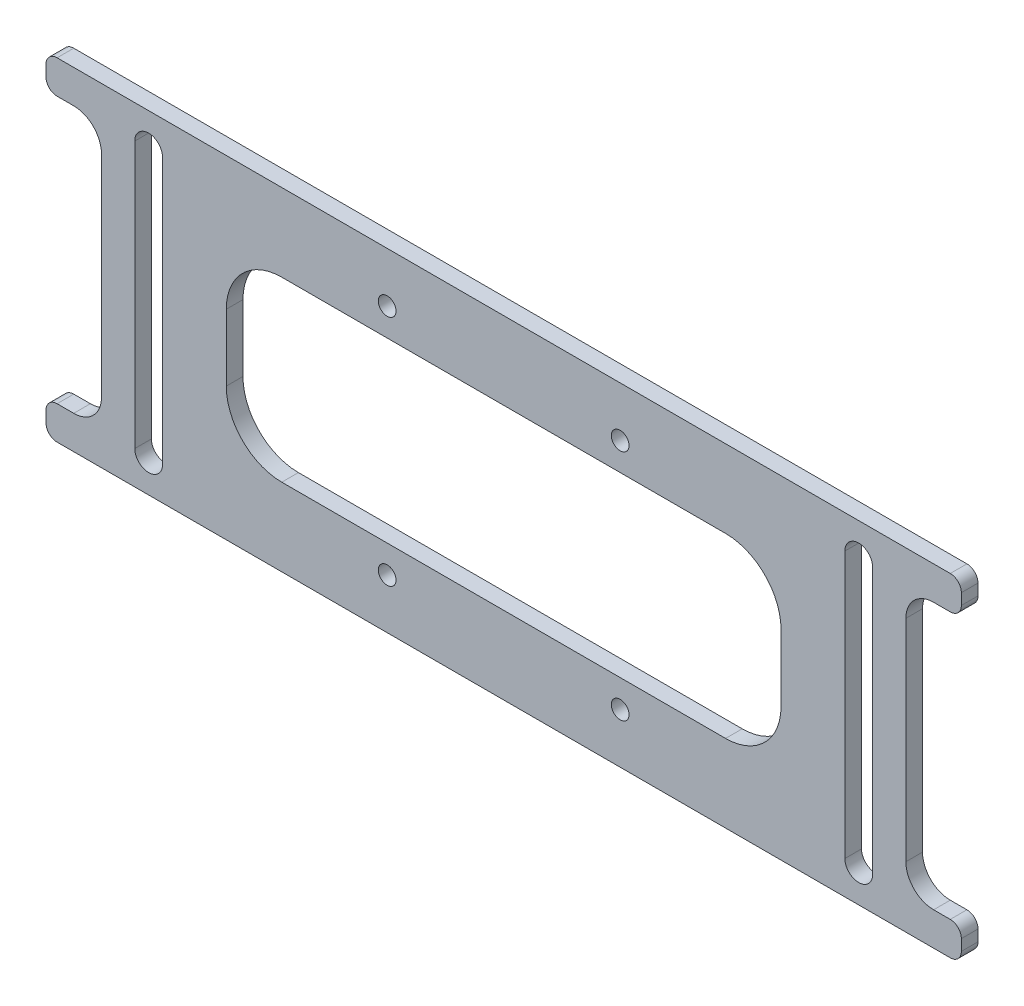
SolidWorks part; units mm, degrees
ref_plane "前视基准面" through (0, 0, 0) normal (0, 0, 1) x (1, 0, 0)
ref_plane "上视基准面" through (0, 0, 0) normal (0, 1, 0) x (1, 0, 0)
ref_plane "右视基准面" through (0, 0, 0) normal (1, 0, 0) x (0, 0, -1)
sketch "草图1" plane through (0, 0, 0) normal (0, 0, 1) x (1, 0, 0)
  line L1 (-82.5, 30) -> (82.5, 30)
  line L2 (-82.5, 30) -> (-82.5, -30)
  line L3 (-82.5, -30) -> (82.5, -30)
  line L4 (82.5, 30) -> (82.5, -30)
  line L5 (-82.5, 30) -> (82.5, -30) construction
  line L6 (-82.5, -30) -> (82.5, 30) construction
  point P0 (0, 0)
  dimension "D1" = 60
  dimension "D2" = 165
extrude "凸台-拉伸1" add sketch "草图1" along normal blind 3
hole_wizard "Ø3.2 (3.2) 直径孔1" positions "草图2" profile "草图3" hole size "Ø3.2" standard "GB"
sketch "草图2" plane through (0, 0, 3) normal (0, 0, 1) x (1, 0, 0)
  point P0 (-21, 21)
  point P2 (-21, -21)
  point P4 (21, 21)
  point P6 (21, -21)
  dimension "D1" = 42
  dimension "D2" = 42
  dimension "D3" = 42
  dimension "D4" = 42
  dimension "D5" = 21
  dimension "D6" = 21
  dimension "D7" = 21
  dimension "D8" = 21
sketch "草图3" plane through (-21, 21, 3) normal (1, 0, 0) x (0, -1, 0)
  line L0 (0, 0) -> (0, 3)
  line L1 (0, 3) -> (1.6, 3)
  line L2 (1.6, 3) -> (1.6, 0)
  line L5 (1.6, 0) -> (0, 0)
  line L11 (0, -6.35) -> (0, 107.95) construction
  dimension "通孔孔直径" = 3.2
  dimension "通孔孔深度" = 3
sketch "草图4" plane through (0, 0, 3) normal (0, 0, 1) x (1, 0, 0)
  line L0 (-64, 24) -> (-64, -24) construction
  line L1 (-61.5, 24) -> (-61.5, -24)
  line L2 (-66.5, 24) -> (-66.5, -24)
  line L3 (64, 24) -> (64, -24) construction
  line L4 (66.5, 24) -> (66.5, -24)
  line L5 (61.5, 24) -> (61.5, -24)
  line L6 (-82.5, 30) -> (-82.5, -30) construction
  line L7 (82.5, 30) -> (-82.5, 30) construction
  line L8 (-82.5, -30) -> (82.5, -30) construction
  line L9 (-82.5, 24) -> (-72.5, 24)
  line L10 (-72.5, 24) -> (-72.5, -24)
  line L11 (-72.5, -24) -> (-82.5, -24)
  line L12 (82.5, 24) -> (72.5, 24)
  line L13 (82.5, -30) -> (82.5, 30) construction
  line L14 (72.5, 24) -> (72.5, -24)
  line L15 (72.5, -24) -> (82.5, -24)
  arc A0 (-61.5, 24) -> (-66.5, 24) centre (-64, 24) ccw
  arc A1 (-66.5, -24) -> (-61.5, -24) centre (-64, -24) ccw
  arc A2 (66.5, 24) -> (61.5, 24) centre (64, 24) ccw
  arc A3 (61.5, -24) -> (66.5, -24) centre (64, -24) ccw
  point P2 (-64, 0)
  point P7 (64, 0)
  dimension "D2" = 2.5
  dimension "D3" = 2.5
  dimension "D8" = 6
  dimension "D1" = 128
  dimension "D4" = 18.5
  dimension "D5" = 48
  dimension "D6" = 6
  dimension "D7" = 48
  dimension "D9" = 10
  dimension "D10" = 10
  dimension "D11" = 24
  dimension "D12" = 24
extrude "切除-拉伸2" cut sketch "草图4" against normal blind 3 contours L11 L10 L9 M11 | L14 L15 L12 M9 | L1 A1 L2 A0 | L4 A3 L5 A2
sketch "草图5" plane through (0, 0, 3) normal (0, 0, 1) x (1, 0, 0)
  line L1 (-50, -16) -> (50, -16)
  line L2 (-50, -16) -> (-50, 16)
  line L3 (-50, 16) -> (50, 16)
  line L4 (50, -16) -> (50, 16)
  line L5 (-50, -16) -> (50, 16) construction
  line L6 (-50, 16) -> (50, -16) construction
  point P0 (0, 0)
  dimension "D1" = 32
  dimension "D2" = 100
extrude "切除-拉伸3" cut sketch "草图5" against normal blind 3
fillet "圆角2" radius 10 4 edges at (50, -16, 1.5) (-50, -16, 1.5) (50, 16, 1.5) (-50, 16, 1.5)
fillet "圆角3" radius 2 8 edges at (82.5, -30, 1.5) (82.5, -24, 1.5) (82.5, 24, 1.5) (82.5, 30, 1.5) (-82.5, -30, 1.5) (-82.5, -24, 1.5) (-82.5, 24, 1.5) (-82.5, 30, 1.5)
fillet "圆角4" radius 5 4 edges at (72.5, -24, 1.5) (72.5, 24, 1.5) (-72.5, -24, 1.5) (-72.5, 24, 1.5)
